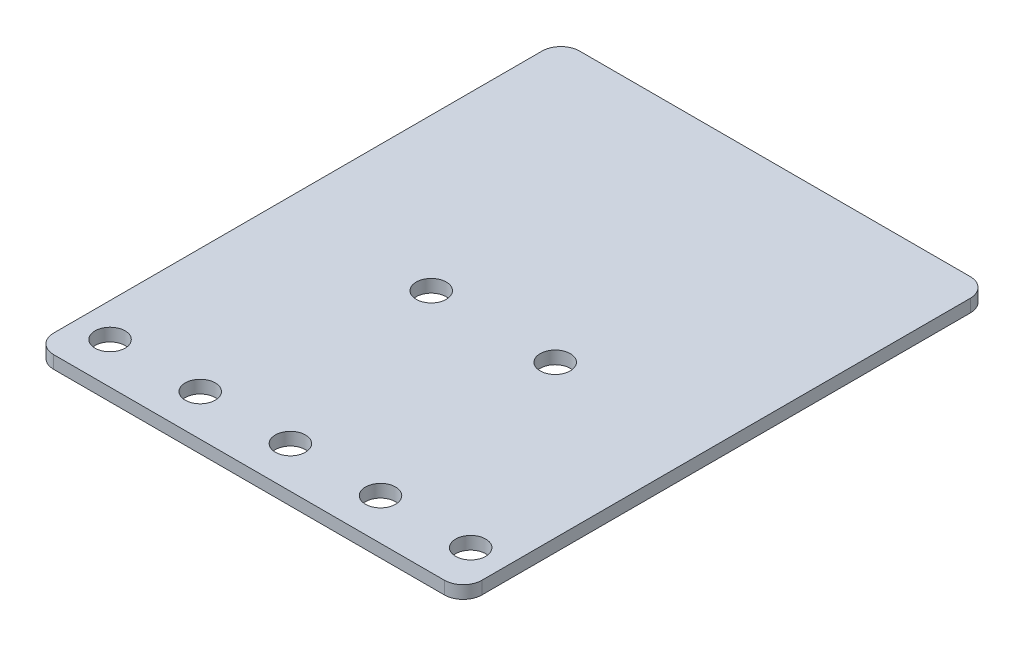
SolidWorks part; units mm, degrees
ref_plane "Plan de face" through (0, 0, 0) normal (0, 0, 1) x (1, 0, 0)
ref_plane "Plan de dessus" through (0, 0, 0) normal (0, 1, 0) x (1, 0, 0)
ref_plane "Plan de droite" through (0, 0, 0) normal (1, 0, 0) x (0, 0, -1)
sketch "Esquisse1" plane through (0, 0, 0) normal (0, 1, 0) x (1, 0, 0)
  line L0 (-32.4528, 0) -> (33.9952, 0) construction
  line L1 (0, 37.0933) -> (0, -40.6938) construction
  line L2 (-16.5118, -2.5) -> (36.1549, -2.5) construction
  line L3 (-26, 35) -> (26, 35)
  line L4 (-28.5, 32.5) -> (-28.5, -32.5)
  line L5 (-26, -35) -> (26, -35)
  line L6 (28.5, 32.5) -> (28.5, -32.5)
  line L7 (-30.1524, -29.5) -> (34.8137, -29.5) construction
  arc A0 (-28.5, -32.5) -> (-26, -35) centre (-26, -32.5) ccw
  arc A1 (26, -35) -> (28.5, -32.5) centre (26, -32.5) ccw
  arc A2 (26, 35) -> (28.5, 32.5) centre (26, 32.5) cw
  arc A3 (-26, 35) -> (-28.5, 32.5) centre (-26, 32.5) ccw
  circle A4 centre (8.25, -2.5) radius 2
  circle A5 centre (-8.25, -2.5) radius 2
  circle A6 centre (0, -29.5) radius 2
  circle A7 centre (12, -29.5) radius 2
  circle A8 centre (24, -29.5) radius 2
  circle A9 centre (-12, -29.5) radius 2
  circle A10 centre (-24, -29.5) radius 2
  dimension "D3" = 2.5
  dimension "D5" = 4
  dimension "D6" = 4
  dimension "D8" = 4
  dimension "D1" = 70
  dimension "D2" = 57
  dimension "D4" = 2.5
  dimension "D7" = 16.5
  dimension "D11" = 27
  dimension "D12" = 12
  dimension "D13" = 12
  dimension "D9" = 3
  dimension "D10" = 3
extrude "Boss.-Extru.1" add sketch "Esquisse1" along normal blind 1.7
